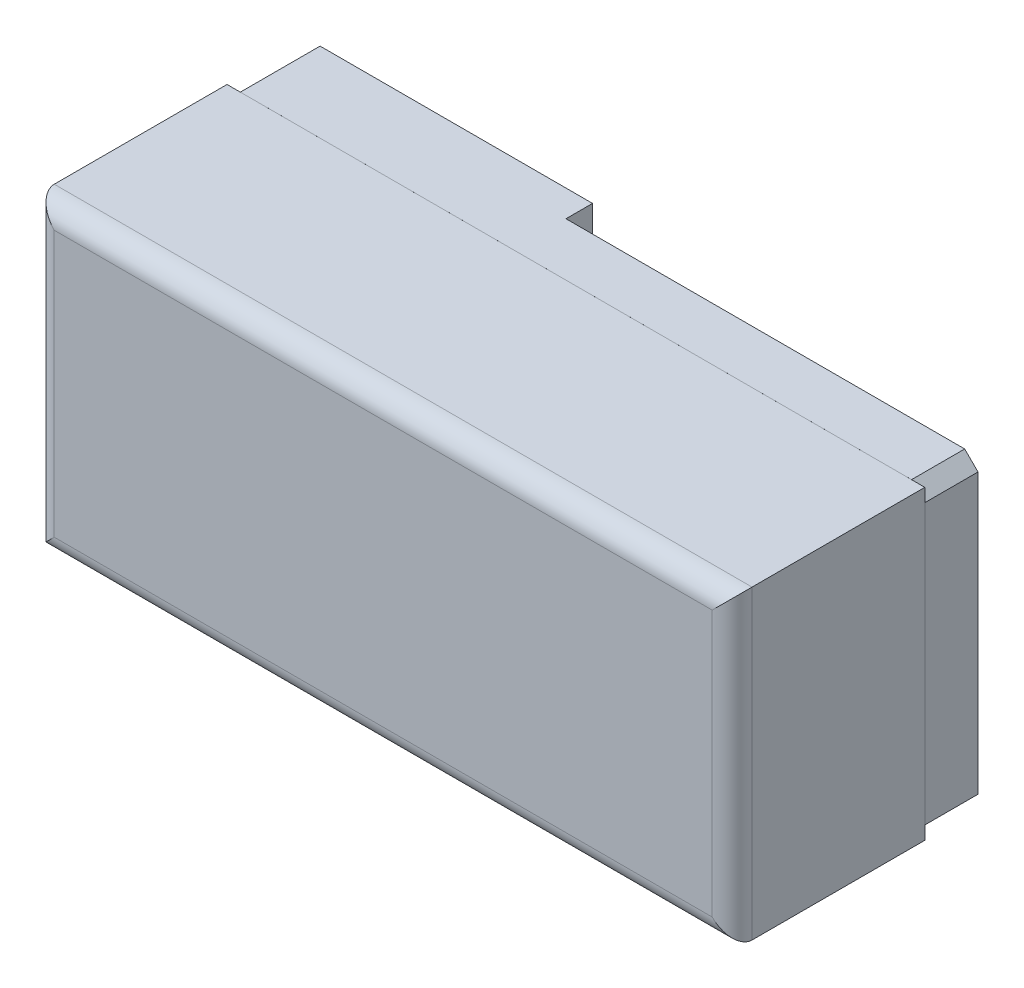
SolidWorks part; units mm, degrees
ref_plane "前视基准面" through (0, 0, 0) normal (0, 0, 1) x (1, 0, 0)
ref_plane "上视基准面" through (0, 0, 0) normal (0, 1, 0) x (1, 0, 0)
ref_plane "右视基准面" through (0, 0, 0) normal (1, 0, 0) x (0, 0, -1)
sketch "草图1" plane through (0, 0, 0) normal (0, 0, 1) x (1, 0, 0)
  line L1 (0, 0) -> (50000, 0) construction
  line L2 (0, 0) -> (0, 50000) construction
  line L3 (-52.5, -23) -> (52.5, -23)
  line L4 (-52.5, -23) -> (-52.5, 23)
  line L5 (-52.5, 23) -> (52.5, 23)
  line L6 (52.5, -23) -> (52.5, 23)
  line L7 (-52.5, -23) -> (52.5, 23) construction
  line L8 (-52.5, 23) -> (52.5, -23) construction
  point P0 (0, 0)
  dimension "D1" = 105
  dimension "D2" = 46
extrude "凸台-拉伸1" add sketch "草图1" along normal blind 12
sketch "草图2" plane through (0, 0, 12) normal (0, 0, 1) x (1, 0, 0)
  line L0 (0, 0) -> (50000, 0) construction
  line L1 (-31.5, -4.609) -> (-31.5, 49995.391) construction
  line L2 (27, -7.691) -> (27, -5.5896) construction
  line L3 (-52.5, 23) -> (-52.5, -23) construction
  line L4 (22, 0) -> (32, 0) construction
  line L5 (22, 5) -> (32, 5)
  line L6 (22, -5) -> (32, -5)
  circle A0 centre (-31.5, 0) radius 8
  arc A1 (22, 5) -> (22, -5) centre (22, 0) ccw
  arc A2 (32, -5) -> (32, 5) centre (32, 0) ccw
  point P13 (27, 0)
  dimension "D3" = 16
  dimension "D4" = 5
  dimension "D1" = 21
  dimension "D2" = 58.5
  dimension "D5" = 10
extrude "切除-拉伸1" cut sketch "草图2" against normal blind 20
sketch "草图3" plane through (0, 0, 12) normal (0, 0, 1) x (1, 0, 0)
  line L0 (41.5, -2.9794) -> (41.5, 49997.0206) construction
  line L1 (26.1169, 11.5) -> (50026.1169, 11.5) construction
  line L2 (34.6113, -11.5) -> (50034.6113, -11.5) construction
  line L3 (-0.5, -19.3341) -> (-0.5, 49980.6659) construction
  line L4 (52.5, -23) -> (52.5, 23) construction
  line L5 (52.5, 23) -> (-52.5, 23) construction
  line L7 (39.5, 11.5) -> (43.5, 11.5) construction
  line L8 (39.5, 13.75) -> (43.5, 13.75)
  line L9 (39.5, 9.25) -> (43.5, 9.25)
  line L10 (-2.5, 11.5) -> (1.5, 11.5) construction
  line L11 (-2.5, 13.75) -> (1.5, 13.75)
  line L12 (-2.5, 9.25) -> (1.5, 9.25)
  line L13 (-2.5, -11.5) -> (1.5, -11.5) construction
  line L14 (-2.5, -9.25) -> (1.5, -9.25)
  line L15 (-2.5, -13.75) -> (1.5, -13.75)
  line L16 (39.5, -11.5) -> (43.5, -11.5) construction
  line L17 (39.5, -9.25) -> (43.5, -9.25)
  line L18 (39.5, -13.75) -> (43.5, -13.75)
  arc A0 (39.5, 13.75) -> (39.5, 9.25) centre (39.5, 11.5) ccw
  arc A1 (43.5, 9.25) -> (43.5, 13.75) centre (43.5, 11.5) ccw
  arc A2 (-2.5, 13.75) -> (-2.5, 9.25) centre (-2.5, 11.5) ccw
  arc A3 (1.5, 9.25) -> (1.5, 13.75) centre (1.5, 11.5) ccw
  arc A4 (-2.5, -9.25) -> (-2.5, -13.75) centre (-2.5, -11.5) ccw
  arc A5 (1.5, -13.75) -> (1.5, -9.25) centre (1.5, -11.5) ccw
  arc A6 (39.5, -9.25) -> (39.5, -13.75) centre (39.5, -11.5) ccw
  arc A7 (43.5, -13.75) -> (43.5, -9.25) centre (43.5, -11.5) ccw
  point P14 (41.5, 11.5)
  point P21 (-0.5, 11.5)
  point P28 (-0.5, -11.5)
  point P35 (41.5, -11.5)
  dimension "D5" = 4.5
  dimension "D1" = 11
  dimension "D2" = 11.5
  dimension "D3" = 42
  dimension "D4" = 23
  dimension "D6" = 4
  dimension "D7" = 4.5
  dimension "D8" = 4
  dimension "D9" = 4.5
  dimension "D10" = 4
  dimension "D11" = 4.5
  dimension "D12" = 4
sketch "草图7" plane through (0, 0, 12) normal (0, 0, 1) x (1, 0, 0)
  line L1 (52.5, -23) -> (52.5, 23) construction
  line L2 (55.75, 0) -> (-49944.25, 0) construction
  line L4 (43.5, -2.9808) -> (43.5, 49997.0192) construction
  line L5 (-14.5, -3.521) -> (-14.5, 49996.479) construction
  point P0 (-14.5, 0)
  point P1 (43.5, 0)
  point P4 (52.5, 0)
  dimension "D1" = 9
  dimension "D2" = 58
hole_wizard "M4 螺纹孔1" positions "3D草图2" profile "草图8" tap size "M4" standard "GB"
sketch3d "3D草图2"
  point P0 (-14.5, 0, 12)
  point P3 (43.5, 0, 12)
sketch "草图8" plane through (-14.5, 0, 12) normal (1, 0, 0) x (0, -1, 0)
  line L0 (0, 0) -> (0, 12)
  line L1 (0, 12) -> (1.65, 12)
  line L2 (1.65, 12) -> (1.65, 0)
  line L5 (1.65, 0) -> (0, 0)
  line L11 (0, -6.35) -> (0, 107.95) construction
  dimension "通孔螺纹孔钻头直径" = 3.3
  dimension "通孔螺纹孔钻头深度" = 12
chamfer "倒角2" distance 2 angle 45 4 edges at (-52.5, -23, 6) (52.5, -23, 6) (-52.5, 23, 6) (52.5, 23, 6)
sketch "草图9" plane through (0, 0, 0) normal (0, 0, -1) x (-1, 0, 0)
  line L0 (-52.5, -21) -> (-52.5, 21) construction
  line L1 (-75.4225, 37.1627) -> (9.5, 37.1627)
  line L2 (-75.4225, 37.1627) -> (-75.4225, -32.4778)
  line L3 (-75.4225, -32.4778) -> (9.5, -32.4778)
  line L4 (9.5, 37.1627) -> (9.5, -32.4778)
  dimension "D1" = 62
extrude "切除-拉伸4" cut sketch "草图9" against normal blind 4
sketch "草图10" plane through (0, 0, 12) normal (0, 0, 1) x (1, 0, 0)
  line L0 (52.5, 23) -> (-52.5, 23)
  line L1 (-52.5, 21) -> (-52.5, -21) construction
  line L2 (-52.5, -23) -> (-52.5, 23)
  line L3 (52.5, -21) -> (52.5, 21) construction
  line L4 (52.5, 23) -> (52.5, -23)
  line L6 (52.5, -23) -> (-52.5, -23)
extrude "凸台-拉伸2" add sketch "草图10" along normal blind 29
fillet "圆角1" radius 3 4 edges at (-52.5, 0, 41) (0, 23, 41) (52.5, 0, 41) (0, -23, 41)
sketch "草图11" plane through (0, 0, 12) normal (0, 0, -1) x (-1, 0, 0)
  line L1 (-60.2888, 27.2563) -> (60.7701, 27.2563)
  line L2 (-60.2888, 27.2563) -> (-60.2888, -30.6257)
  line L3 (-60.2888, -30.6257) -> (60.7701, -30.6257)
  line L4 (60.7701, 27.2563) -> (60.7701, -30.6257)
extrude "切除-拉伸5" cut sketch "草图11" against normal blind 0.001
